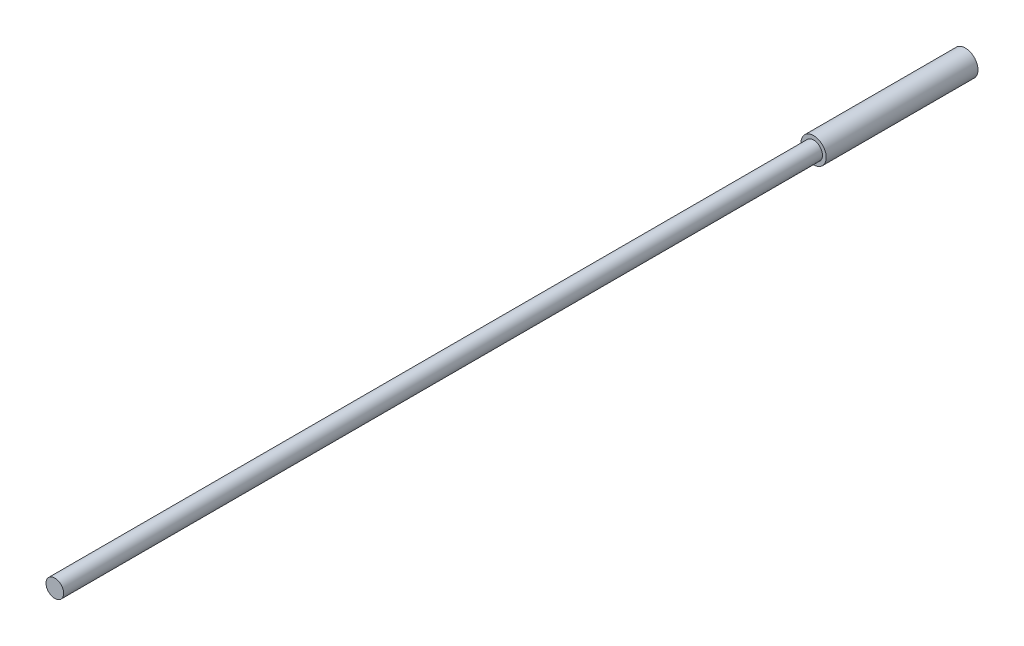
SolidWorks part; units mm, degrees
ref_plane "前视基准面" through (0, 0, 0) normal (0, 0, 1) x (1, 0, 0)
ref_plane "上视基准面" through (0, 0, 0) normal (0, 1, 0) x (1, 0, 0)
ref_plane "右视基准面" through (0, 0, 0) normal (1, 0, 0) x (0, 0, -1)
sketch "草图1" plane through (0, 0, 0) normal (0, 0, 1) x (1, 0, 0)
  circle A0 centre (0, 0) radius 0.5
  dimension "D1" = 1
extrude "凸台-拉伸1" add sketch "草图1" along normal blind 6
sketch "草图2" plane through (0, 0, 6) normal (0, 0, 1) x (1, 0, 0)
  circle A0 centre (0, 0) radius 0.35
  dimension "D1" = 0.7
extrude "凸台-拉伸2" add sketch "草图2" along normal blind 30
sketch "草图3" plane through (0, 0, 0) normal (0, 0, -1) x (-1, 0, 0)
  circle A0 centre (0, 0) radius 0.1325
  circle A1 centre (0, 0) radius 0.1375
  dimension "D1" = 0.275
  dimension "D2" = 0.265
extrude "切除-拉伸1" cut sketch "草图3" against normal blind 0.1
